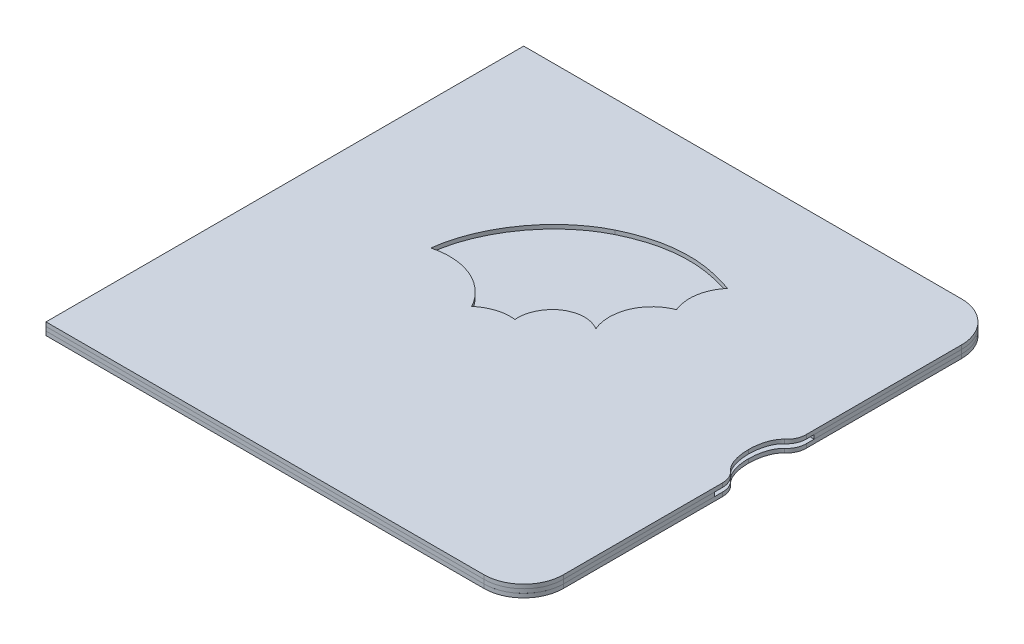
SolidWorks part; units mm, degrees
ref_plane "Front Plane" through (0, 0, 0) normal (0, 0, 1) x (1, 0, 0)
ref_plane "Top Plane" through (0, 0, 0) normal (0, 1, 0) x (1, 0, 0)
ref_plane "Right Plane" through (0, 0, 0) normal (1, 0, 0) x (0, 0, -1)
sketch "Sketch5" plane through (0, 0, 0) normal (0, 1, 0) x (1, 0, 0)
  line L0 (-60.0396, 59.8042) -> (49.9604, 59.8042)
  line L1 (59.9604, 49.8042) -> (59.9604, 10.806)
  line L2 (59.9604, -10.288) -> (59.9604, -50.1958)
  line L3 (49.9604, -60.1958) -> (-60.0396, -60.1958)
  line L4 (-60.0396, -60.1958) -> (-60.0396, 59.8042)
  arc A0 (49.9604, 59.8042) -> (59.9604, 49.8042) centre (49.9604, 49.8042) cw
  arc A1 (49.9604, -60.1958) -> (59.9604, -50.1958) centre (49.9604, -50.1958) ccw
  spline S1 degree 3 poles (59.9604, 10.806) (59.9604, 9.3172) (59.3809, 8.0358) (58.2632, 7.0523) knots 0.272727 0.272727 0.272727 0.272727 0.363636 0.363636 0.363636 0.363636
  spline S2 degree 3 poles (58.2632, 7.0523) (56.9027, 5.8552) (55.9604, 3.2634) (55.9604, 0.259) knots 0.363636 0.363636 0.363636 0.363636 0.454545 0.454545 0.454545 0.454545
  spline S3 degree 3 poles (55.9604, 0.259) (55.9604, -2.7454) (56.9027, -5.3372) (58.2632, -6.5343) knots 0.454545 0.454545 0.454545 0.454545 0.545455 0.545455 0.545455 0.545455
  spline S4 degree 3 poles (58.2632, -6.5343) (59.3809, -7.5178) (59.9604, -8.7992) (59.9604, -10.288) knots 0.545455 0.545455 0.545455 0.545455 0.636364 0.636364 0.636364 0.636364
  dimension "D1" = 110
  dimension "D2" = 120
extrude "Boss-Extrude3" add sketch "Sketch5" along normal blind 1
sketch "Sketch8" plane through (0, 1, 0) normal (0, 1, 0) x (1, 0, 0)
  line L0 (-60.0396, 59.8042) -> (49.9604, 59.8042)
  line L1 (59.9604, 49.8042) -> (59.9604, 12.759)
  line L2 (59.9604, 12.759) -> (58.4806, 12.759)
  line L3 (58.4806, -12.241) -> (59.9604, -12.241)
  line L4 (59.9604, -12.241) -> (59.9604, -50.1958)
  line L5 (49.9604, -60.1958) -> (-60.0396, -60.1958)
  line L6 (-60.0396, -60.1958) -> (-60.0396, 59.8042)
  circle A0 centre (6.5945, 0.258) radius 3
  ellipse E0 centre (6.5945, 0.258) end of major axis (6.5945, 3.258) minor radius 3 construction
  spline S0 degree 3 poles (49.9604, 59.8042) (55.4682, 59.8042) (59.9604, 55.3116) (59.9604, 49.8042) knots 0.076923 0.076923 0.076923 0.076923 0.153846 0.153846 0.153846 0.153846
  spline S1 degree 3 poles (58.4806, 12.759) (52.8539, 36.1974) (31.761, 53.618) (6.5969, 53.618) knots 0.307692 0.307692 0.307692 0.307692 0.384615 0.384615 0.384615 0.384615
  spline S2 degree 3 poles (6.5969, 53.618) (-22.8724, 53.618) (-46.7621, 29.7283) (-46.7621, 0.259) knots 0.384615 0.384615 0.384615 0.384615 0.461538 0.461538 0.461538 0.461538
  spline S3 degree 3 poles (-46.7621, 0.259) (-46.7621, -29.2103) (-22.8724, -53.1) (6.5969, -53.1) knots 0.461538 0.461538 0.461538 0.461538 0.538462 0.538462 0.538462 0.538462
  spline S4 degree 3 poles (6.5969, -53.1) (31.761, -53.1) (52.8539, -35.6794) (58.4806, -12.241) knots 0.538462 0.538462 0.538462 0.538462 0.615385 0.615385 0.615385 0.615385
  spline S5 degree 3 poles (59.9604, -50.1958) (59.9604, -55.7032) (55.4678, -60.1958) (49.9604, -60.1958) knots 0.769231 0.769231 0.769231 0.769231 0.846154 0.846154 0.846154 0.846154
extrude "Boss-Extrude5" add sketch "Sketch8" along normal blind 1 separate body
sketch "Sketch10" plane through (0, 2, 0) normal (0, 1, 0) x (1, 0, 0)
  line L0 (-60.0396, 59.8042) -> (49.9604, 59.8042)
  line L1 (59.9604, 49.8042) -> (59.9604, 10.806)
  line L2 (59.9604, -10.288) -> (59.9604, -50.1958)
  line L3 (49.9604, -60.1958) -> (-60.0396, -60.1958)
  line L4 (-60.0396, -60.1958) -> (-60.0396, 59.8042)
  spline S0 degree 3 poles (49.9604, 59.8042) (55.4682, 59.8042) (59.9604, 55.3116) (59.9604, 49.8042) knots 0.090909 0.090909 0.090909 0.090909 0.181818 0.181818 0.181818 0.181818
  spline S1 degree 3 poles (59.9604, 10.806) (59.9604, 9.3172) (59.3809, 8.0358) (58.2632, 7.0523) knots 0.272727 0.272727 0.272727 0.272727 0.363636 0.363636 0.363636 0.363636
  spline S2 degree 3 poles (58.2632, 7.0523) (56.9027, 5.8552) (55.9604, 3.2634) (55.9604, 0.259) knots 0.363636 0.363636 0.363636 0.363636 0.454545 0.454545 0.454545 0.454545
  spline S3 degree 3 poles (55.9604, 0.259) (55.9604, -2.7454) (56.9027, -5.3372) (58.2632, -6.5343) knots 0.454545 0.454545 0.454545 0.454545 0.545455 0.545455 0.545455 0.545455
  spline S4 degree 3 poles (58.2632, -6.5343) (59.3809, -7.5178) (59.9604, -8.7992) (59.9604, -10.288) knots 0.545455 0.545455 0.545455 0.545455 0.636364 0.636364 0.636364 0.636364
  spline S5 degree 3 poles (59.9604, -50.1958) (59.9604, -55.7032) (55.4678, -60.1958) (49.9604, -60.1958) knots 0.727273 0.727273 0.727273 0.727273 0.818182 0.818182 0.818182 0.818182
  spline S6 degree 3 poles (-27.7753, 4.1925) (-26.4401, 15.5149) (-18.3845, 26.4954) (-8.5135, 31.2762) knots 0.961538 0.961538 0.961538 0.961538 1 1 1 1
  spline S7 degree 3 poles (-24.3845, 4.7404) (-25.5535, 4.6823) (-26.6883, 4.4948) (-27.7753, 4.1925) knots 0.923077 0.923077 0.923077 0.923077 0.961538 0.961538 0.961538 0.961538
  spline S8 degree 3 poles (-21.0863, 4.5573) (-21.905, 4.6905) (-23.0421, 4.7598) (-24.1611, 4.7598) (-24.1251, 4.7525) (-24.3845, 4.7404) knots 0.846154 0.846154 0.846154 0.846154 0.884615 0.884615 0.923077 0.923077 0.923077 0.923077
  spline S9 degree 3 poles (-17.8945, 3.6783) (-18.9104, 4.0795) (-19.9788, 4.3767) (-21.0863, 4.5573) knots 0.807692 0.807692 0.807692 0.807692 0.846154 0.846154 0.846154 0.846154
  spline S10 degree 3 poles (-14.7757, 2.0126) (-15.7417, 2.68) (-16.787, 3.2409) (-17.8945, 3.6783) knots 0.769231 0.769231 0.769231 0.769231 0.807692 0.807692 0.807692 0.807692
  spline S11 degree 3 poles (-11.5309, -0.9899) (-12.4635, 0.1577) (-13.5566, 1.1698) (-14.7757, 2.0126) knots 0.730769 0.730769 0.730769 0.730769 0.769231 0.769231 0.769231 0.769231
  spline S12 degree 3 poles (-9.9293, -3.3827) (-10.3896, -2.5343) (-10.9267, -1.7338) (-11.5309, -0.9899) knots 0.692308 0.692308 0.692308 0.692308 0.730769 0.730769 0.730769 0.730769
  spline S13 degree 3 poles (-8.1066, -2.0819) (-8.7599, -2.452) (-9.3705, -2.8887) (-9.9293, -3.3827) knots 0.653846 0.653846 0.653846 0.653846 0.692308 0.692308 0.692308 0.692308
  spline S14 degree 3 poles (-4.9414, -0.903) (-6.0706, -1.1287) (-7.1357, -1.5318) (-8.1066, -2.0819) knots 0.615385 0.615385 0.615385 0.615385 0.653846 0.653846 0.653846 0.653846
  spline S15 degree 3 poles (-1.649, -0.7598) (-2.0365, -0.7174) (-2.2678, -0.6949) (-3.3898, -0.6949) (-4.2584, -0.7665) (-4.9414, -0.903) knots 0.538462 0.538462 0.538462 0.538462 0.576923 0.576923 0.615385 0.615385 0.615385 0.615385
  spline S16 degree 3 poles (10.5147, 7.4112) (8.2537, 8.6483) (5.8201, 8.9907) (0.0847, 6.2127) (-2.0359, 2.6243) (-1.649, -0.7598) knots 0.461538 0.461538 0.461538 0.461538 0.5 0.5 0.538462 0.538462 0.538462 0.538462
  spline S17 degree 3 poles (9.6537, 11.2883) (9.6983, 9.915) (10.0009, 8.607) (10.5147, 7.4112) knots 0.423077 0.423077 0.423077 0.423077 0.461538 0.461538 0.461538 0.461538
  spline S18 degree 3 poles (10.0555, 14.5814) (9.7899, 13.6473) (9.6473, 12.211) (9.6473, 11.0734) (9.6492, 11.4058) (9.6537, 11.2883) knots 0.346154 0.346154 0.346154 0.346154 0.384615 0.384615 0.423077 0.423077 0.423077 0.423077
  spline S19 degree 3 poles (11.4613, 17.6115) (10.8441, 16.6923) (10.3655, 15.6723) (10.0555, 14.5814) knots 0.307692 0.307692 0.307692 0.307692 0.346154 0.346154 0.346154 0.346154
  spline S20 degree 3 poles (13.9728, 20.2484) (12.9936, 19.5191) (12.143, 18.6267) (11.4613, 17.6115) knots 0.269231 0.269231 0.269231 0.269231 0.307692 0.307692 0.307692 0.307692
  spline S21 degree 3 poles (16.4952, 21.6444) (15.5881, 21.2925) (14.7407, 20.8208) (13.9728, 20.2484) knots 0.230769 0.230769 0.230769 0.230769 0.269231 0.269231 0.269231 0.269231
  spline S22 degree 3 poles (16.053, 22.9631) (16.1724, 22.5112) (16.3205, 22.0709) (16.4952, 21.6444) knots 0.192308 0.192308 0.192308 0.192308 0.230769 0.230769 0.230769 0.230769
  spline S23 degree 3 poles (15.7357, 26.6016) (15.7113, 26.3067) (15.6983, 26.3323) (15.6983, 25.0825) (15.8217, 23.839) (16.053, 22.9631) knots 0.115385 0.115385 0.115385 0.115385 0.153846 0.153846 0.192308 0.192308 0.192308 0.192308
  spline S24 degree 3 poles (16.512, 29.8109) (16.0966, 28.8087) (15.8284, 27.73) (15.7357, 26.6016) knots 0.076923 0.076923 0.076923 0.076923 0.115385 0.115385 0.115385 0.115385
  spline S25 degree 3 poles (18.2733, 32.6785) (17.5449, 31.8276) (16.9472, 30.8614) (16.512, 29.8109) knots 0.038462 0.038462 0.038462 0.038462 0.076923 0.076923 0.076923 0.076923
  spline S26 degree 3 poles (-8.5135, 31.2762) (1.3575, 36.057) (9.8262, 35.7255) (18.2733, 32.6785) knots 0 0 0 0 0.038462 0.038462 0.038462 0.038462
  spline S27 degree 3 poles (-2.8288, -0.6949) (-3.552, -0.6949) (-4.2584, -0.7665) (-4.9414, -0.903) knots 0.5 0.5 0.5 0.5 1 1 1 1
  spline S28 degree 3 poles (-4.9414, -0.903) (-4.2584, -0.7665) (-3.552, -0.6949) (-2.8288, -0.6949) knots 0 0 0 0 0.5 0.5 0.5 0.5
extrude "Boss-Extrude7" add sketch "Sketch10" along normal blind 1 separate body contours M13 M1 M2 M3 M4 M5 M6 M7 M8 M9 M10 M11 M12 | S4 S3 S2 S1 L1 L2 S6 S26 S25 S24 S23 S22 S21 S20 S19 S18 S17 S16 S15 S14 S13 S12 S11 S10 S9 S8 S7 M10 M9 M8 M7 M6 M5
